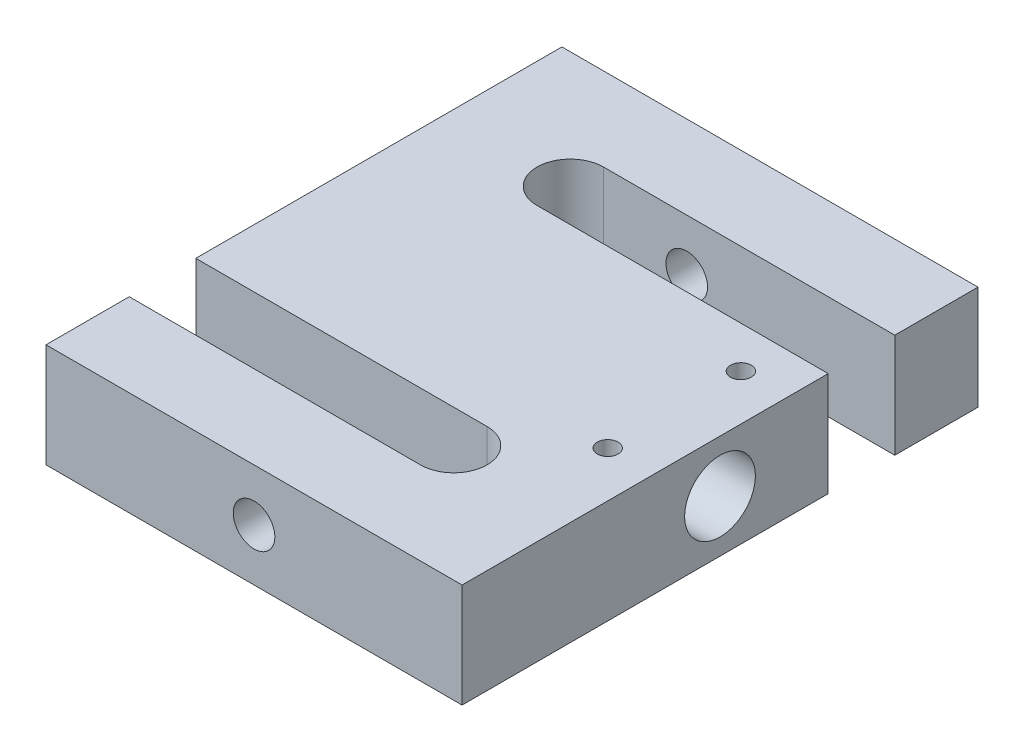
SolidWorks part; units mm, degrees
ref_plane "Face" through (0, 0, 0) normal (0, 0, 1) x (1, 0, 0)
ref_plane "Dessus" through (0, 0, 0) normal (0, 1, 0) x (1, 0, 0)
ref_plane "Droite" through (0, 0, 0) normal (1, 0, 0) x (0, 0, -1)
sketch "Esquisse1" plane through (0, 0, 0) normal (0, 1, 0) x (1, 0, 0)
  line L0 (50, 48) -> (0, 48) construction
  line L1 (0, 0) -> (50, 0)
  line L2 (0, 0) -> (0, 10)
  line L3 (0, 62) -> (50, 62)
  line L4 (50, 0) -> (50, 44)
  line L5 (50, 31) -> (0, 31) construction
  line L6 (50, 14) -> (0, 14) construction
  line L7 (15, 52) -> (50, 52)
  line L8 (15, 44) -> (50, 44)
  line L9 (35, 18) -> (0, 18)
  line L10 (35, 10) -> (0, 10)
  line L11 (0, 18) -> (0, 62)
  line L12 (50, 52) -> (50, 62)
  line L13 (44.5, 48) -> (44.5, 14) construction
  arc A0 (15, 52) -> (15, 44) centre (15, 48) ccw
  arc A2 (35, 10) -> (35, 18) centre (35, 14) ccw
  point P26 (44.5, 39)
  point P27 (44.5, 23)
  dimension "D1" = 50
  dimension "D2" = 62
  dimension "D5" = 8
  dimension "D6" = 8
  dimension "D7" = 15
  dimension "D8" = 15
  dimension "D3" = 17
  dimension "D4" = 17
  dimension "D9" = 5.5
  dimension "D10" = 16
extrude "Boss.-Extru.1" add sketch "Esquisse1" along normal blind 12.5
hole_wizard "Trou pour taraudage pour trou taraudé M31" positions "Esquisse2" profile "Esquisse3" hole size "M3" standard "ISO"
sketch "Esquisse2" plane through (0, 12.5, 0) normal (0, 1, 0) x (1, 0, 0)
  point P0 (44.5, 39)
  point P3 (44.5, 23)
sketch "Esquisse3" plane through (44.5, 12.5, -39) normal (1, 0, 0) x (0, 0, 1)
  line L0 (0, 0) -> (0, 12.5)
  line L1 (0, 12.5) -> (1.25, 12.5)
  line L2 (1.25, 12.5) -> (1.25, 0)
  line L5 (1.25, 0) -> (0, 0)
  line L11 (0, -6.35) -> (0, 107.95) construction
  dimension "Diamètre du perçage jusqu'au prochain" = 2.5
  dimension "Profondeur du perçage jusqu'au prochain" = 12.5
sketch "Esquisse4" plane through (0, 0, 0) normal (0, 0, 1) x (1, 0, 0)
  line L0 (0, 6.25) -> (50, 6.25) construction
  line L1 (0, 12.5) -> (0, 0) construction
  line L2 (50, 12.5) -> (50, 0) construction
  line L3 (25, 12.5) -> (25, 0) construction
  line L4 (0, 12.5) -> (50, 12.5) construction
  line L5 (0, 0) -> (50, 0) construction
hole_wizard "Trou pour taraudage pour trou taraudé M61" positions "Esquisse5" profile "Esquisse6" hole size "M6" standard "ISO"
sketch "Esquisse5" plane through (0, 0, 0) normal (0, 0, 1) x (1, 0, 0)
  line L0 (0, 6.25) -> (50, 6.25) construction
  point P0 (25, 6.25)
sketch "Esquisse6" plane through (25, 6.25, 0) normal (1, 0, 0) x (0, -1, 0)
  line L0 (0, 0) -> (0, 10)
  line L1 (0, 10) -> (2.5, 10)
  line L2 (2.5, 10) -> (2.5, 0)
  line L5 (2.5, 0) -> (0, 0)
  line L11 (0, -6.35) -> (0, 107.95) construction
  dimension "Diamètre du perçage jusqu'au prochain" = 5
  dimension "Profondeur du perçage jusqu'au prochain" = 10
hole_wizard "Trou pour taraudage pour trou taraudé M62" positions "Esquisse7" profile "Esquisse8" hole size "M6" standard "ISO"
sketch "Esquisse7" plane through (0, 0, -62) normal (0, 0, -1) x (-1, 0, 0)
  line L0 (0, 6.25) -> (-50, 6.25) construction
  point P0 (-25, 6.25)
sketch "Esquisse8" plane through (25, 6.25, -62) normal (1, 0, 0) x (0, 1, 0)
  line L0 (0, 0) -> (0, 10)
  line L1 (0, 10) -> (2.5, 10)
  line L2 (2.5, 10) -> (2.5, 0)
  line L5 (2.5, 0) -> (0, 0)
  line L11 (0, -6.35) -> (0, 107.95) construction
  dimension "Diamètre du perçage jusqu'au prochain" = 5
  dimension "Profondeur du perçage jusqu'au prochain" = 10
sketch "Esquisse9" plane through (50, 0, 0) normal (1, 0, 0) x (0, 0, -1)
  line L0 (31, 0) -> (31, 12.5) construction
  line L1 (0, 12.5) -> (44, 12.5) construction
hole_wizard "Trou pour taraudage pour trou taraudé M101" positions "Esquisse10" profile "Esquisse11" hole size "M10" standard "ISO"
sketch "Esquisse10" plane through (50, 0, 0) normal (1, 0, 0) x (0, 0, -1)
  line L0 (31, 0) -> (31, 12.5) construction
  point P0 (31, 6.25)
sketch "Esquisse11" plane through (50, 6.25, -31) normal (0, 1, 0) x (0, 0, -1)
  line L0 (0, 0) -> (0, 12.5537)
  line L1 (0, 12.5537) -> (4.25, 10)
  line L2 (4.25, 10) -> (4.25, 0)
  line L5 (4.25, 0) -> (0, 0)
  line L10 (0, 12.5537) -> (-4.25, 10) construction
  line L11 (0, -6.35) -> (0, 107.95) construction
  dimension "Diamètre du perçage" = 8.5
  dimension "Profondeur du perçage" = 10
  dimension "Angle de pointe" = 118
